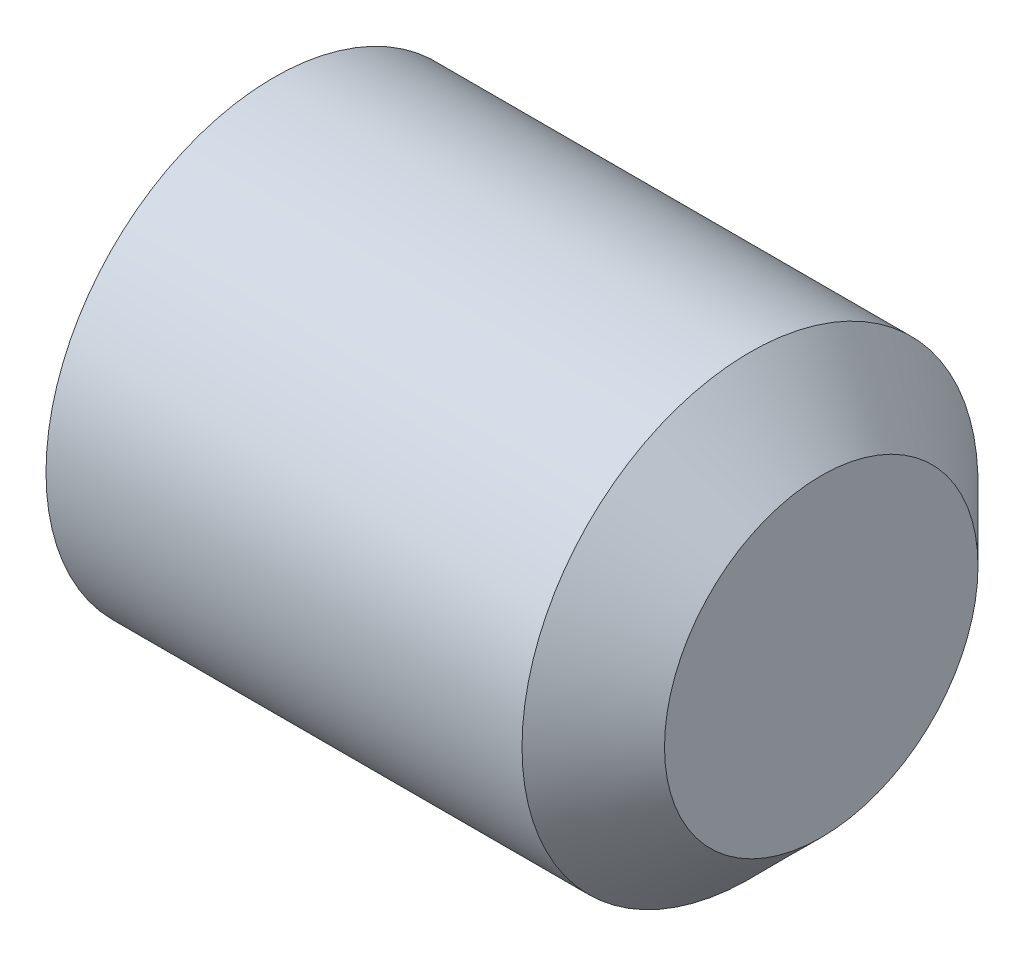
SolidWorks part; units mm, degrees
ref_plane "Plane1" through (0, 0, 0) normal (0, 0, 1) x (1, 0, 0)
ref_plane "Plane2" through (0, 0, 0) normal (0, 1, 0) x (1, 0, 0)
ref_plane "Plane3" through (0, 0, 0) normal (1, 0, 0) x (0, 0, -1)
sketch "BodySke" plane through (0, 0, 0) normal (0, 0, 1) x (1, 0, 0)
  line L0 (0, 0) -> (0, 3.3095)
  line L1 (0, 3.3095) -> (0.3987, 4)
  line L2 (0.3987, 4) -> (8.75, 4)
  line L3 (8.75, 4) -> (10, 2.75)
  line L4 (10, 0) -> (0, 0)
  line L5 (-12.7, 0) -> (88.9, 0) construction
  line L6 (10, 2.75) -> (10, 0)
  line L7 (10, 2.75) -> (10, 12.275) construction
  line L8 (0, -3.3095) -> (0.3987, -4) construction
  line L9 (1.25, 15.875) -> (1.25, -3.175) construction
  line L10 (8.75, -4) -> (10, -2.75) construction
  dimension "Length" = 10
  dimension "Diameter" = 8
  dimension "Drive_ch_ang" = 60
  dimension "Minor_dia" = 6.619
  dimension "Cup_nose_ang" = 45
  dimension "Cup_dia" = 5.5
  dimension "Advance" = 1.25
revolve "BaseBody" add sketch "BodySke" angle 360 about L5
sketch "Sketch2" plane through (0, 0, 0) normal (-1, 0, 0) x (0, 0, 1)
  line L0 (1.1547, 2) -> (-1.1547, 2)
  line L1 (-1.1547, 2) -> (-2.3094, 0)
  line L2 (1.1547, 2) -> (2.3094, 0)
  line L3 (1.1547, -2) -> (2.3094, 0)
  line L4 (1.1547, -2) -> (-1.1547, -2)
  line L5 (-1.1547, -2) -> (-2.3094, 0)
  dimension "Hex_size" = 4
  dimension "D2" = 2
  dimension "D3" = 2
extrude "Hex" cut sketch "Sketch2" against normal blind 5
sketch "ThdSchSke" plane through (0, 0, 0) normal (0, 0, 1) x (1, 0, 0)
  line L0 (0.3987, -3.3095) -> (-0.0848, -4)
  line L1 (0.3987, -3.3095) -> (0.8822, -4)
  line L2 (0.8822, -4) -> (0.8822, -5)
  line L3 (-3.175, 0) -> (5.1513, 0) construction
  line L5 (0.8822, -5) -> (-0.0848, -5)
  line L6 (-0.0848, -5) -> (-0.0848, -4)
  line L8 (0.3987, 4) -> (0.3987, -4) construction
  dimension "Thread_minor" = 6.619
  dimension "Diameter" = 8
  dimension "SideAngle" = 55
  dimension "VeeAngle" = 70
  dimension "Overcut" = 10
revolve "ThreadSchematic" [suppressed] cut sketch "ThdSchSke" angle 360 about L3
pattern_linear "ThdSchPat" [suppressed]
equation "\"D2@Sketch2\" = \"Hex_size@Sketch2\" / 2"
equation "\"D3@Sketch2\" = \"Hex_size@Sketch2\" / 2"
equation "\"Thread_minor@ThreadCosmetic\" = \"Minor_dia@BodySke\""
equation "\"Thread_minor@ThdSchSke\" = \"Thread_minor@ThreadCosmetic\""
equation "\"Diameter@ThdSchSke\" = \"Diameter@BodySke\""
equation "\"Overcut@ThdSchSke\" = \"Diameter@BodySke\" * 1.25"
equation "\"Num_threads@ThdSchPat\" = int( (\"Length@BodySke\" - ( ( ( \"Diameter@BodySke\" - \"Minor_dia@BodySke\" ) * 0.5 ) / tan( \"Drive_ch_ang@BodySke\" * 0.017453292 ) ) - ( ( ( \"Diameter@BodySke\" - \"Cup_dia@BodySk"
equation "\"Advance@ThdSchPat\" = (\"Length@BodySke\" - ( ( ( \"Diameter@BodySke\" - \"Minor_dia@BodySke\" ) * 0.5 ) / tan( \"Drive_ch_ang@BodySke\" * 0.017453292 ) ) - ( ( ( \"Diameter@BodySke\" - \"Cup_dia@BodySke\" ) * 0."
equation "' \"Num_threads@ThdSchPat\" = \"Num_threads@ThdSchPat\" - sgn( \"Num_threads@ThdSchPat\" - 1) '---chamfered tips only---"
